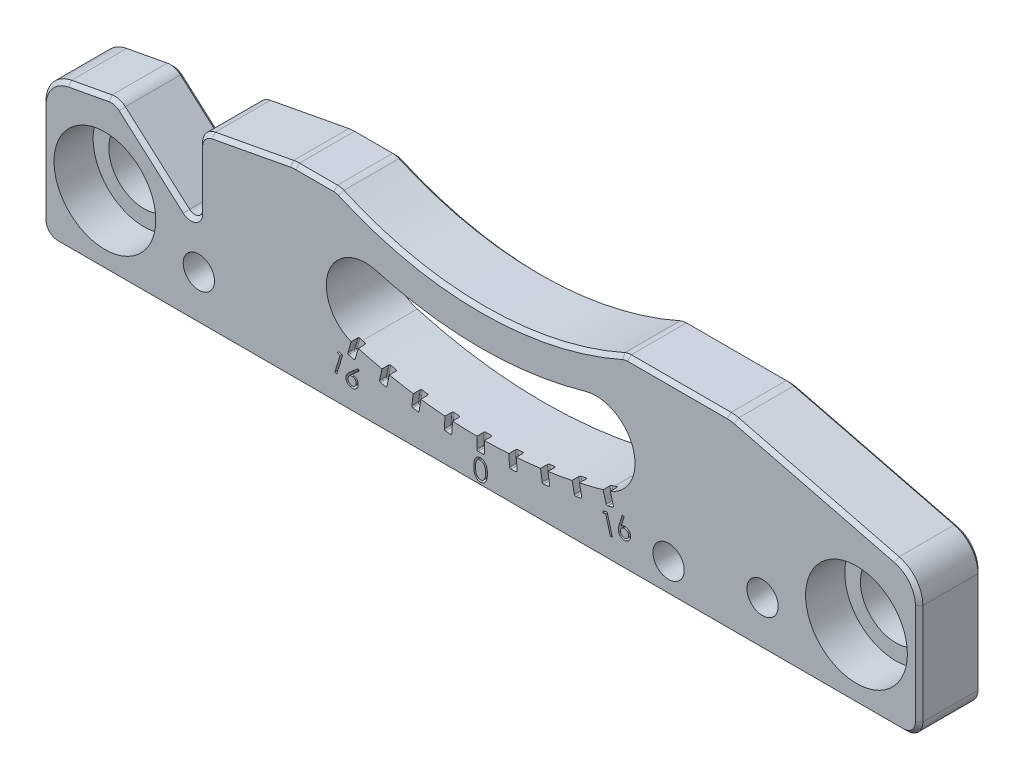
SolidWorks part; units mm, degrees
ref_plane "Front" through (0, 0, 0) normal (0, 0, 1) x (1, 0, 0)
ref_plane "Top" through (0, 0, 0) normal (0, 1, 0) x (1, 0, 0)
ref_plane "Right" through (0, 0, 0) normal (1, 0, 0) x (0, 0, -1)
sketch "Sketch1" plane through (0, 0, 0) normal (0, 0, 1) x (1, 0, 0)
  line L0 (0, 67.1585) -> (0, -46.3958) construction
  line L1 (44.45, 0) -> (-44.45, 0)
  line L2 (-44.45, 0) -> (-44.45, 19.05)
  line L3 (44.45, 0) -> (44.45, 19.05)
  line L4 (-44.45, 19.05) -> (44.45, 19.05)
  point P6 (0, 0)
  point P9 (0, 19.05)
  dimension "D1" = 88.9
  dimension "D2" = 19.05
extrude "Base-Extrude" add sketch "Sketch1" along normal blind 6.35
sketch "Sketch2" plane through (0, 0, 6.35) normal (0, 0, 1) x (1, 0, 0)
  line L0 (44.45, 14.2875) -> (25.4, 19.05)
  line L1 (44.45, 0) -> (44.45, 19.05) construction
  line L2 (-44.45, 19.05) -> (44.45, 19.05) construction
  line L3 (44.45, 0) -> (-44.45, 0) construction
  line L4 (25.4, 19.05) -> (44.45, 19.05)
  line L5 (44.45, 14.2875) -> (44.45, 19.05)
  dimension "D1" = 14.2875
  dimension "D2" = 19.05
extrude "Cut-Extrude1" cut sketch "Sketch2" against normal through all
sketch "Sketch3" plane through (0, 0, 6.35) normal (0, 0, 1) x (1, 0, 0)
  line L0 (-44.45, 19.05) -> (25.4, 19.05) construction
  line L1 (0, -3.4925) -> (0, 3.4925) construction
  line L2 (44.45, 0) -> (-44.45, 0) construction
  arc A0 (-14.5497, 19.05) -> (14.5497, 19.05) centre (0, 50.8) ccw
  dimension "D1" = 34.925
  dimension "D2" = 50.8
extrude "Cut-Extrude2" cut sketch "Sketch3" against normal through all
sketch "Sketch4" plane through (0, 0, 6.35) normal (0, 0, 1) x (1, 0, 0)
  line L0 (-44.45, 14.2875) -> (-19.05, 19.05)
  line L1 (-44.45, 0) -> (-44.45, 19.05) construction
  line L2 (-44.45, 19.05) -> (-14.5497, 19.05) construction
  dimension "D1" = 25.4
extrude "Cut-Extrude3" cut sketch "Sketch4" against normal through all
sketch "Sketch5" plane through (0, 0, 6.35) normal (0, 0, 1) x (1, 0, 0)
  line L0 (-36.9844, 15.6873) -> (-28.575, 8.2623)
  line L1 (-44.45, 14.2875) -> (-19.05, 19.05) construction
  line L2 (-19.05, 19.05) -> (-30.473, 6.1126) construction
  line L3 (-28.575, 8.2623) -> (-28.575, 17.2641)
  line L4 (-36.9844, 15.6873) -> (-28.575, 17.2641)
  line L5 (0, 58.217) -> (0, 5.9282) construction
  arc A0 (-14.5497, 19.05) -> (14.5497, 19.05) centre (0, 50.8) ccw construction
  point P11 (0, 50.8)
  dimension "D1" = 90
  dimension "D2" = 50.8
  dimension "D3" = 28.575
extrude "Cut-Extrude4" cut sketch "Sketch5" against normal through all
sketch "Sketch6" plane through (0, 0, 6.35) normal (0, 0, 1) x (1, 0, 0)
  line L0 (0, 50.8) -> (-14.5667, 0) construction
  line L1 (44.45, 0) -> (-44.45, 0) construction
  line L2 (0, 50.8) -> (14.5667, 0) construction
  line L3 (0, 65.7216) -> (0, 19.1245) construction
  arc A0 (-10.5871, 13.8784) -> (10.5871, 13.8784) centre (0, 50.8) ccw
  arc A1 (-14.5497, 19.05) -> (14.5497, 19.05) centre (0, 50.8) ccw construction
  arc A2 (12.775, 6.2483) -> (-12.775, 6.2483) centre (0, 50.8) cw
  arc A3 (11.517, 10.6356) -> (-11.517, 10.6356) centre (0, 50.8) cw construction
  arc A4 (-12.775, 6.2483) -> (-10.5871, 13.8784) centre (-11.681, 10.0634) cw
  arc A5 (10.5871, 13.8784) -> (12.775, 6.2483) centre (11.681, 10.0634) cw
  point P16 (0, 12.3904)
  point P17 (0, 9.017)
  point P18 (0, 4.4529)
  dimension "D2" = 41.783
  dimension "D3" = 7.9375
  dimension "D1" = 32
  dimension "D4" = 3.3734
extrude "Cut-Extrude5" cut sketch "Sketch6" against normal through all
fillet "Fillet1" radius 3.175 4 edges at (44.45, 14.2875, 3.175) (25.4, 19.05, 3.175) (-19.05, 19.05, 3.175) (-44.45, 14.2875, 3.175)
hole_wizard "Hole1" positions "Sketch8" profile "Sketch9" legacy
sketch "Sketch8" plane through (0, 0, 6.35) normal (0, 0, 1) x (1, 0, 0)
  line L0 (0, -3.4925) -> (0, 3.4925) construction
  line L1 (44.45, 0) -> (-44.45, 0) construction
  point P0 (38.1, 7.1438)
  dimension "D1" = 38.1
  dimension "D2" = 7.1437
sketch "Sketch9" plane through (38.1, 7.1438, 6.35) normal (1, 0, 0) x (0, -1, 0)
  line L0 (0, 0) -> (0, 6.35)
  line L1 (0, 6.35) -> (3.5719, 6.35)
  line L2 (3.5719, 6.35) -> (3.5719, 3.9688)
  line L3 (3.5719, 3.9688) -> (5.1594, 3.9688)
  line L4 (5.1594, 3.9688) -> (5.1594, 0)
  line L5 (5.1594, 0) -> (0, 0)
  line L6 (0, 110) -> (0, -10) construction
pattern_linear "LPattern1" count 2 spacing 76.2 along (-1, 0, 0) of "Hole1"
other "Hole2"
sketch "Sketch10" plane through (0, 0, 6.35) normal (0, 0, 1) x (1, 0, 0)
  line L0 (44.45, 0) -> (-44.45, 0) construction
  line L1 (0, -3.4925) -> (0, 3.4925) construction
  circle A0 centre (28.575, 4.7625) radius 1.5875
  dimension "D1" = 3.175
  dimension "D2" = 4.7625
  dimension "D3" = 28.575
sketch "Sketch11" plane through (-6.4225, 2.9366, 6.35) normal (0, 0, 1) x (1, 0, 0)
  line L0 (50.8725, -2.9366) -> (-38.0275, -2.9366) construction
  line L1 (6.4225, -6.4291) -> (6.4225, 0.5559) construction
  circle A0 centre (25.4725, 0.2384) radius 1.5875
  dimension "D1" = 3.175
  dimension "D2" = 3.175
  dimension "D3" = 19.05
other "Hole3"
pattern_linear "LPattern2" count 2 spacing 57.15 along (-1, 0, 0) of "Hole2"
fillet "Fillet2" radius 1.5875 6 edges at (14.5497, 19.05, 3.175) (-14.5497, 19.05, 3.175) (-36.9844, 15.6873, 3.175) (-28.575, 17.2641, 3.175) (-44.45, 0, 3.175) (44.45, 0, 3.175)
fillet "Fillet3" radius 0.7937 1 edges at (-28.575, 8.2623, 3.175)
sketch "Sketch13" plane through (0, 0, 6.35) normal (0, 0, 1) x (1, 0, 0)
  line L0 (0, 0) -> (0, 21.1407) construction
  line L1 (-0.381, 3.1845) -> (-0.381, 5.7245)
  line L2 (0.381, 3.1845) -> (0.381, 5.7245)
  arc A2 (-12.4249, 7.4691) -> (12.4249, 7.4691) centre (0, 50.8) ccw
  arc A4 (-0.381, 5.7245) -> (0.381, 5.7245) centre (0, 50.8) ccw
  arc A5 (-13.125, 5.0275) -> (13.125, 5.0275) centre (0, 50.8) ccw
  arc A6 (-0.381, 3.1845) -> (0.381, 3.1845) centre (0, 50.8) ccw
  dimension "D3" = 1.27
  dimension "D4" = 1.27
extrude "notch" cut sketch "Sketch13" against normal blind 0.7937
fillet "Fillet5" radius 0.127 5 edges at (0, 3.1829, 5.5562) (0.381, 3.1845, 5.9531) (-0.381, 3.8195, 5.5562) (-0.381, 3.1845, 5.9531) (0.381, 3.8195, 5.5562)
pattern_circular "CirPattern1" count 5 every 4 about axis through (0, 50.8, 0) along (0, 0, 1) of "notch", "Fillet5"
mirror "Mirror1" about plane through (0, 0, 0) normal (1, 0, 0) of "CirPattern1", "Fillet5"
sketch "Sketch12" plane through (0, 0, 6.35) normal (0, 0, 1) x (1, 0, 0)
  line L0 (0, 0) -> (0, 25.3851) construction
  arc A2 (-3.0873, 0.738) -> (-0.4123, 0.6446) centre (0, 50.8) ccw
  arc A3 (-15.4671, 3.0873) -> (15.4671, 3.0873) centre (0, 50.8) ccw construction
  text T0 "16" font "Century Gothic" height in points 8
  text T1 "0" font "Century Gothic" height in points 8
  text T2 "16" font "Century Gothic" height in points 8
  dimension "D1" = 3.81
extrude "limit_text" cut sketch "Sketch12" against normal blind 1.5875
chamfer "Chamfer1" distance 0.381 angle 45 44 edges at (0, 15.875, 0) (0, 15.875, 6.35) (44.45, 6.698, 0) (0, 0, 0) (-44.45, 6.62, 0) (-39.8033, 15.1588, 0) (-33.1486, 12.3005, 0) (19.9506, 19.05, 0) (43.985, 0.465, 0) (-43.985, 0.465, 0) (-37.032, 15.5145, 0) (-28.2091, 16.9604, 0) (-14.5611, 19.0151, 0) (14.5611, 19.0151, 0) (19.9506, 19.05, 6.35) (44.45, 6.698, 6.35) (-23.31, 18.2512, 6.35) (-33.1486, 12.3005, 6.35) (-44.45, 6.62, 6.35) (0, 0, 6.35) (43.985, 0.465, 6.35) (-43.985, 0.465, 6.35) (-37.032, 15.5145, 6.35) (-28.2091, 16.9604, 6.35) (-14.5611, 19.0151, 6.35) (14.5611, 19.0151, 6.35) (-28.575, 12.9843, 6.35) (-28.575, 12.9843, 0) (-29.0424, 9.2984, 6.35) (-29.0424, 9.2984, 0) (-39.8033, 15.1588, 6.35) (33.9121, 16.922, 6.35) (-16.8235, 19.05, 6.35) (25.3971, 19.0262, 6.35) (-19.0487, 19.0364, 6.35) (-43.7182, 13.6802, 6.35) (43.7776, 13.7625, 6.35) (33.9121, 16.922, 0) (-23.31, 18.2512, 0) (-16.8235, 19.05, 0) (25.3971, 19.0262, 0) (-19.0487, 19.0364, 0) (-43.7182, 13.6802, 0) (43.7776, 13.7625, 0)
